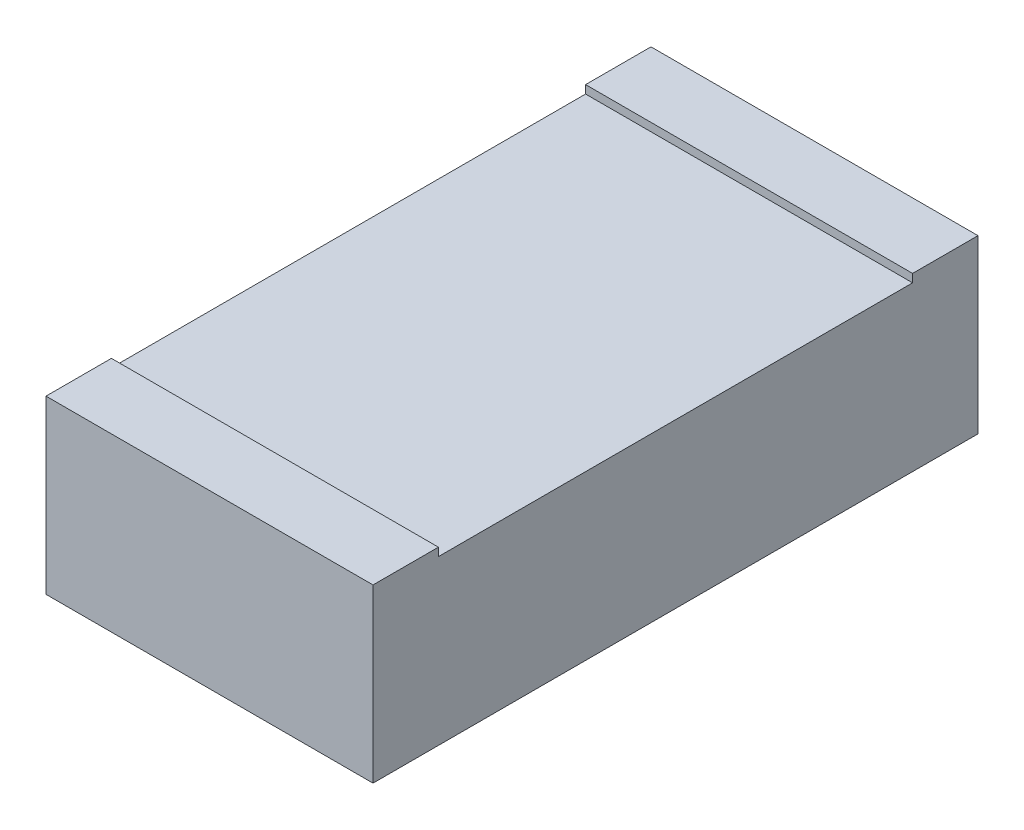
SolidWorks part; units mm, degrees
ref_plane "Plan de face" through (0, 0, 0) normal (0, 0, 1) x (1, 0, 0)
ref_plane "Plan de dessus" through (0, 0, 0) normal (0, 1, 0) x (1, 0, 0)
ref_plane "Plan de droite" through (0, 0, 0) normal (1, 0, 0) x (0, 0, -1)
sketch "Esquisse1" plane through (0, 0, 0) normal (0, 1, 0) x (1, 0, 0)
  line L1 (0.5, -0.925) -> (-0.5, -0.925)
  line L2 (0.5, -0.925) -> (0.5, 0.925)
  line L3 (0.5, 0.925) -> (-0.5, 0.925)
  line L4 (-0.5, -0.925) -> (-0.5, 0.925)
  line L5 (0.5, -0.925) -> (-0.5, 0.925) construction
  line L6 (0.5, 0.925) -> (-0.5, -0.925) construction
  point P0 (0, 0)
  dimension "D1" = 1
  dimension "D2" = 1.85
extrude "Boss.-Extru.1" add sketch "Esquisse1" along normal blind 0.5
sketch "Esquisse2" plane through (0, 0.5, 0) normal (0, 1, 0) x (1, 0, 0)
  line L0 (-0.6571, 0) -> (0.6907, 0) construction
  line L1 (0.5, -0.925) -> (0.5, 0.925) construction
  line L2 (-0.5, 0.925) -> (0.5, 0.925)
  line L3 (-0.5, 0.925) -> (-0.5, 0.725)
  line L4 (-0.5, 0.725) -> (0.5, 0.725)
  line L5 (0.5, 0.925) -> (0.5, 0.725)
  line L6 (0.5, -0.925) -> (0.5, -0.725)
  line L7 (-0.5, -0.925) -> (0.5, -0.925)
  line L8 (-0.5, -0.925) -> (-0.5, -0.725)
  line L9 (-0.5, -0.725) -> (0.5, -0.725)
  dimension "D1" = 0.2
extrude "Boss.-Extru.2" add sketch "Esquisse2" along normal blind 0.025
